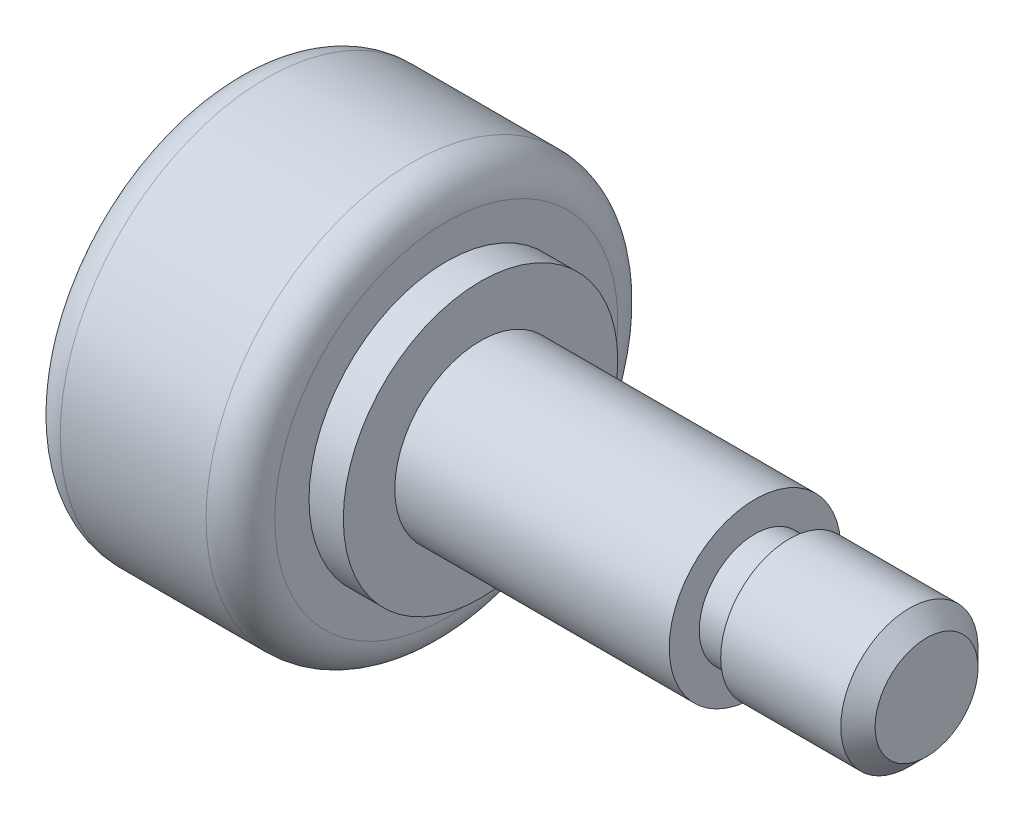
SolidWorks part; units mm, degrees
ref_plane "前视基准面" through (0, 0, 0) normal (0, 0, 1) x (1, 0, 0)
ref_plane "上视基准面" through (0, 0, 0) normal (0, 1, 0) x (1, 0, 0)
ref_plane "右视基准面" through (0, 0, 0) normal (1, 0, 0) x (0, 0, -1)
sketch "草图1" plane through (0, 0, 0) normal (0, 0, 1) x (1, 0, 0)
  line L0 (-31.9099, 0) -> (25.0904, 0) construction
  line L1 (0, 0) -> (0, 4)
  line L2 (0, 4) -> (-8, 4)
  line L3 (-8, 4) -> (-8, 3.25)
  line L4 (-8, 3.25) -> (-10, 3.25)
  line L5 (-10, 3.25) -> (-10, 5)
  line L6 (-10, 5) -> (-26, 5)
  line L7 (-26, 5) -> (-26, 8)
  line L8 (-26, 8) -> (-28, 8)
  line L9 (-28, 8) -> (-28, 12)
  line L10 (-28, 12) -> (-40, 12)
  line L11 (-41.8424, 0) -> (0, 0)
  arc A0 (-40, 12) -> (-41.8424, 0) centre (-1.8424, 0) ccw
  dimension "D3" = 40
  dimension "D1" = 12
  dimension "D2" = 40
  dimension "D4" = 8
  dimension "D5" = 5
  dimension "D6" = 3.25
  dimension "D7" = 4
  dimension "D8" = 2
  dimension "D9" = 10
  dimension "D10" = 2
  dimension "D11" = 28
revolve "旋转1" add sketch "草图1" angle 360 about L11
fillet "圆角1" radius 2 2 edges at (-40, 0, 12) (-28, 0, 12)
chamfer "倒角1" distance 1 angle 45 1 edges at (0, 0, 4)
